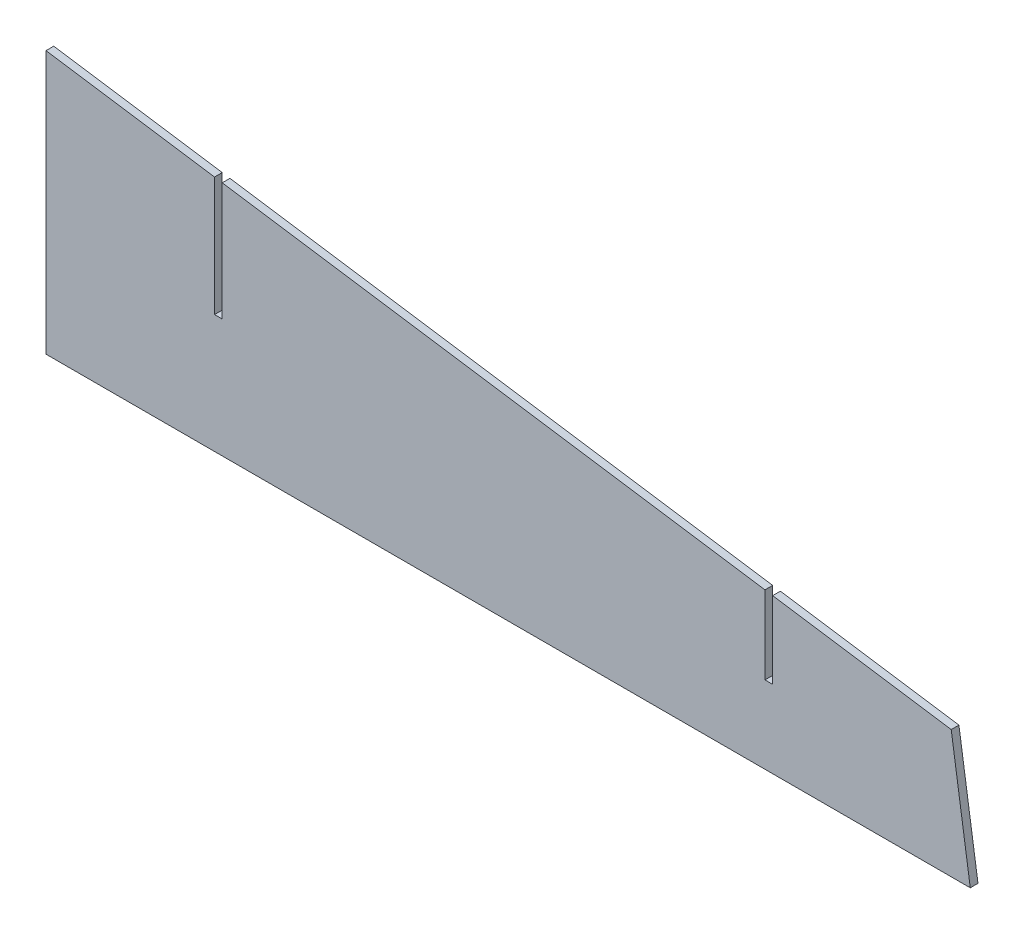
SolidWorks part; units mm, degrees
ref_plane "Front Plane" through (0, 0, 0) normal (0, 0, 1) x (1, 0, 0)
ref_plane "Top Plane" through (0, 0, 0) normal (0, 1, 0) x (1, 0, 0)
ref_plane "Right Plane" through (0, 0, 0) normal (1, 0, 0) x (0, 0, -1)
sketch "Sketch2" plane through (0, 884.5296, 0) normal (0, 1, 0) x (1, 0, 0)
  line L0 (4.3656, -194.8656) -> (1121.9656, -194.8656) construction
  line L1 (1121.9656, -203.5969) -> (1121.9656, -194.8656) construction
  line L2 (4.3656, -203.5969) -> (1121.9656, -203.5969) construction
  line L3 (4.3656, -203.5969) -> (4.3656, -194.8656) construction
  line L4 (4.3656, -194.8656) -> (1121.9656, -194.8656)
  line L5 (1121.9656, -203.5969) -> (1121.9656, -194.8656)
  line L6 (4.3656, -203.5969) -> (1121.9656, -203.5969)
  line L7 (4.3656, -203.5969) -> (4.3656, -194.8656)
extrude "Boss-Extrude1" add sketch "Sketch2" along normal up to surface (297.2201 mm away)
sketch "Sketch3" plane through (0, 0, 203.5969) normal (0, 0, -1) x (-1, 0, 0)
  line L0 (-1121.9656, 884.5296) -> (-4.3656, 884.5296) construction
  line L1 (-194.8656, 884.5296) -> (-203.5969, 884.5296)
  line L2 (-194.8656, 884.5296) -> (-194.8656, 1018.5688)
  line L3 (-194.8656, 1018.5688) -> (-203.5969, 1018.5688)
  line L4 (-203.5969, 884.5296) -> (-203.5969, 1018.5688)
  line L5 (-199.2312, 884.5296) -> (-199.2312, 1018.5688) construction
  line L6 (-817.1656, 884.5296) -> (-825.8969, 884.5296)
  line L7 (-817.1656, 884.5296) -> (-817.1656, 972.0371)
  line L8 (-817.1656, 972.0371) -> (-825.8969, 972.0371)
  line L9 (-825.8969, 884.5296) -> (-825.8969, 972.0371)
  line L10 (-199.2312, 1018.5688) -> (-199.2312, 1152.608) construction
  line L11 (-4.3656, 1181.7497) -> (-1121.9656, 1014.6153) construction
  line L12 (-821.5312, 884.5296) -> (-821.5312, 972.0371) construction
  line L13 (-821.5312, 972.0371) -> (-821.5312, 1059.5445) construction
extrude "Cut-Extrude1" [suppressed] cut sketch "Sketch3" along normal through all
sketch "Sketch4" plane through (4.3656, 0, 0) normal (-1, 0, 0) x (0, 0, 1)
  line L0 (203.5969, 1181.7497) -> (194.8656, 1181.7497)
  line L1 (194.8656, 1181.7497) -> (194.8656, 1183.0554)
  line L2 (194.8656, 1183.0554) -> (203.5969, 1183.0554)
  line L3 (203.5969, 1183.0554) -> (203.5969, 1181.7497)
extrude "Cut-Extrude2" cut sketch "Sketch4" along direction (0.989, -0.1479, 0) on the side against the normal through all
sketch "Sketch5" plane through (0, 0, 194.8656) normal (0, 0, -1) x (-1, 0, 0)
  line L1 (-194.8656, 1018.5688) -> (-203.5969, 1018.5688)
  line L2 (-194.8656, 1018.5688) -> (-194.8656, 1153.2609)
  line L3 (-194.8656, 1153.2609) -> (-203.5969, 1151.9551)
  line L4 (-203.5969, 1018.5688) -> (-203.5969, 1151.9551)
  line L5 (-817.1656, 972.0371) -> (-825.8969, 972.0371)
  line L6 (-817.1656, 972.0371) -> (-817.1656, 1060.1974)
  line L7 (-817.1656, 1060.1974) -> (-825.8969, 1058.8917)
  line L8 (-825.8969, 972.0371) -> (-825.8969, 1058.8917)
  line L9 (-4.3656, 1181.7497) -> (-1121.9656, 1014.6153) construction
  line L10 (-4.3656, 884.5296) -> (-1121.9656, 884.5296) construction
  line L11 (-199.2312, 1152.608) -> (-199.2313, 1018.5688) construction
  line L12 (-199.2313, 1018.5688) -> (-199.2313, 884.5296) construction
  line L13 (-821.5313, 972.0371) -> (-821.5312, 1059.5445) construction
  line L14 (-821.5313, 972.0371) -> (-821.5313, 884.5296) construction
extrude "Cut-Extrude3" cut sketch "Sketch5" against normal through all
ref_plane "Plane1" through (1160.1465, 173.4971, 173.4971) normal (0.9784, 0.1463, 0.1463) x (0.1447, 0.0216, -0.9892)
other "SurfaceCut1"
sketch "Sketch6" plane through (172.9574, 1156.5372, 0) normal (0.1479, 0.989, 0) x (0.989, -0.1479, 0)
  line L1 (865.6496, -194.8656) -> (864.2992, -194.8656)
  line L2 (865.6496, -194.8656) -> (865.6496, -203.5969)
  line L3 (865.6496, -203.5969) -> (864.2992, -203.5969)
  line L4 (864.2992, -194.8656) -> (864.2992, -203.5969)
extrude "Cut-Extrude4" cut sketch "Sketch6" along direction (-0.1479, 0.989, 0) on the side against the normal through all
